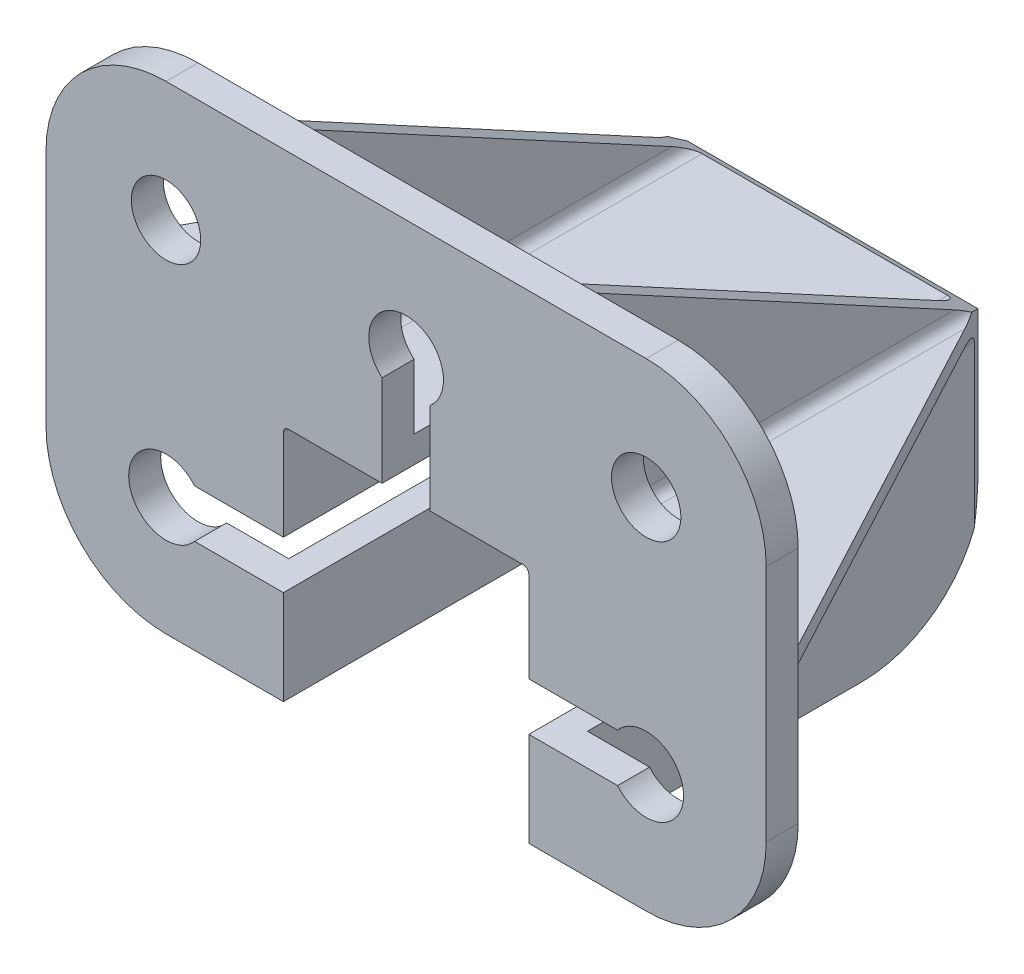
SolidWorks part; units mm, degrees
ref_plane "Front" through (0, 0, 0) normal (0, 0, 1) x (1, 0, 0)
ref_plane "Top" through (0, 0, 0) normal (0, 1, 0) x (1, 0, 0)
ref_plane "Right" through (0, 0, 0) normal (1, 0, 0) x (0, 0, -1)
imported_body "Imported1"
sketch "Sketch1" plane through (0, 0, -6) normal (0, 0, -1) x (-1, 0, 0)
  point P0 (45, 22.5)
  point P1 (-45, 22.5)
hole_wizard "Ø13.0 (13) Diameter Hole1" positions "3DSketch1" profile "Sketch2" hole size "Ø13.0" standard "ANSI Metric"
sketch3d "3DSketch1"
  point P2 (-45, 22.5, -6)
  point P5 (45, 22.5, -6)
  point P8 (-58.0036, 15.6017, -6)
sketch "Sketch2" plane through (-45, 22.5, -6) normal (1, 0, 0) x (0, 1, 0)
  line L0 (0, 0) -> (0, 6)
  line L1 (0, 6) -> (6.5, 6)
  line L2 (6.5, 6) -> (6.5, 0)
  line L5 (6.5, 0) -> (0, 0)
  line L11 (0, -6.35) -> (0, 107.95) construction
  dimension "Thru Hole Dia." = 13
  dimension "Thru Hole Depth" = 6
